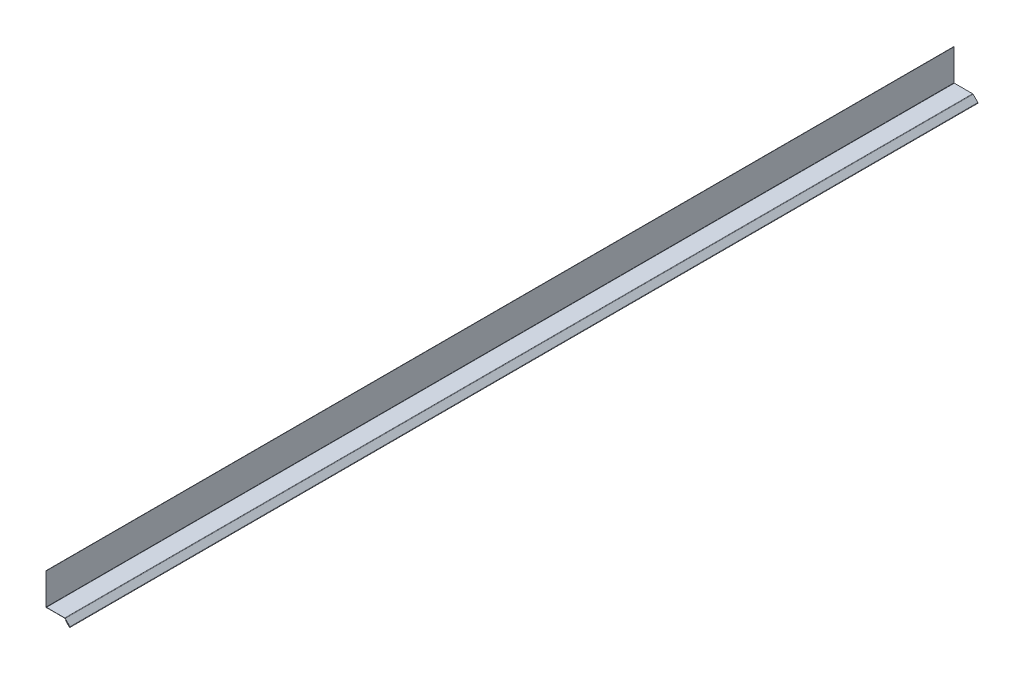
SolidWorks part; units mm, degrees
ref_plane "Front" through (0, 0, 0) normal (0, 0, 1) x (1, 0, 0)
ref_plane "Top" through (0, 0, 0) normal (0, 1, 0) x (1, 0, 0)
ref_plane "Right" through (0, 0, 0) normal (1, 0, 0) x (0, 0, -1)
sketch "Sketch1" plane through (0, 0, 0) normal (0, 0, 1) x (1, 0, 0)
  line L0 (0, 1) -> (0, 69.85)
  line L1 (1, 0) -> (41.275, 0)
  line L2 (41.9934, -0.2976) -> (52.506, -10.8101)
  line L3 (52.506, -11.5172) -> (54.0186, -10.0047) construction
  line L4 (51.7989, -11.5172) -> (43.5314, -3.2498)
  arc A0 (52.506, -10.8101) -> (51.7989, -11.5172) centre (52.1524, -11.1637) cw
  arc A2 (41.9934, -0.2976) -> (41.275, 0) centre (41.275, -1.016) ccw
  arc A3 (0, 1) -> (1, 0) centre (1, 1) ccw
  point P18 (0, 0)
  dimension "D5" = 1.016
  dimension "D3" = 12.192
  dimension "D2" = 15.367
  dimension "D1" = 69.85
  dimension "D4" = 225
  dimension "D6" = 1
  dimension "D7" = 41.275
extrude "Extrude-Thin1" add sketch "Sketch1" along normal blind 2000 thin
